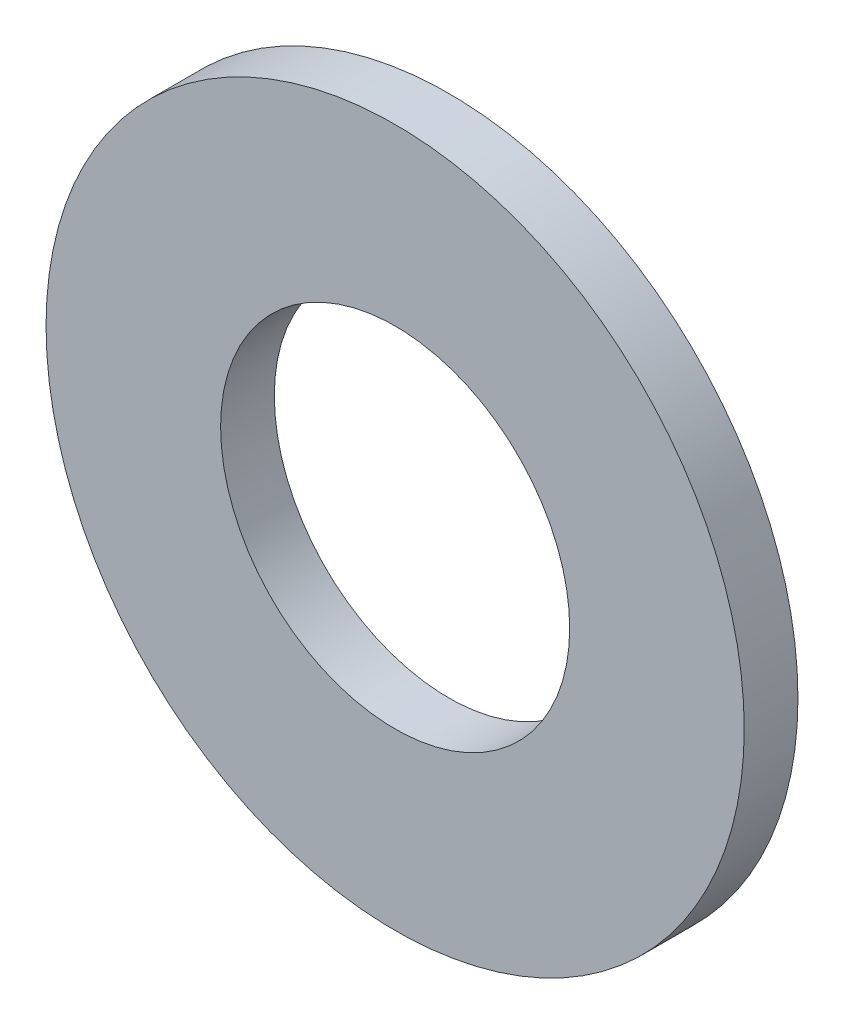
SolidWorks part; units mm, degrees
ref_plane "Plan1" through (0, 0, 0) normal (0, 0, 1) x (1, 0, 0)
ref_plane "Plan2" through (0, 0, 0) normal (0, 1, 0) x (1, 0, 0)
ref_plane "Plan3" through (0, 0, 0) normal (1, 0, 0) x (0, 0, -1)
sketch "Esquisse1" plane through (0, 0, 0) normal (0, 0, 1) x (1, 0, 0)
  circle A0 centre (0, 0) radius 6.5
  dimension "D1" = 13
extrude "Base-Extrusion" add sketch "Esquisse1" along normal blind 1
sketch "Esquisse2" plane through (0, 0, 0) normal (0, 0, -1) x (-1, 0, 0)
  circle A0 centre (0, 0) radius 3.25
  dimension "D1" = 6.5
extrude "Enlèv. mat.-Extru.1" cut sketch "Esquisse2" against normal blind 1
